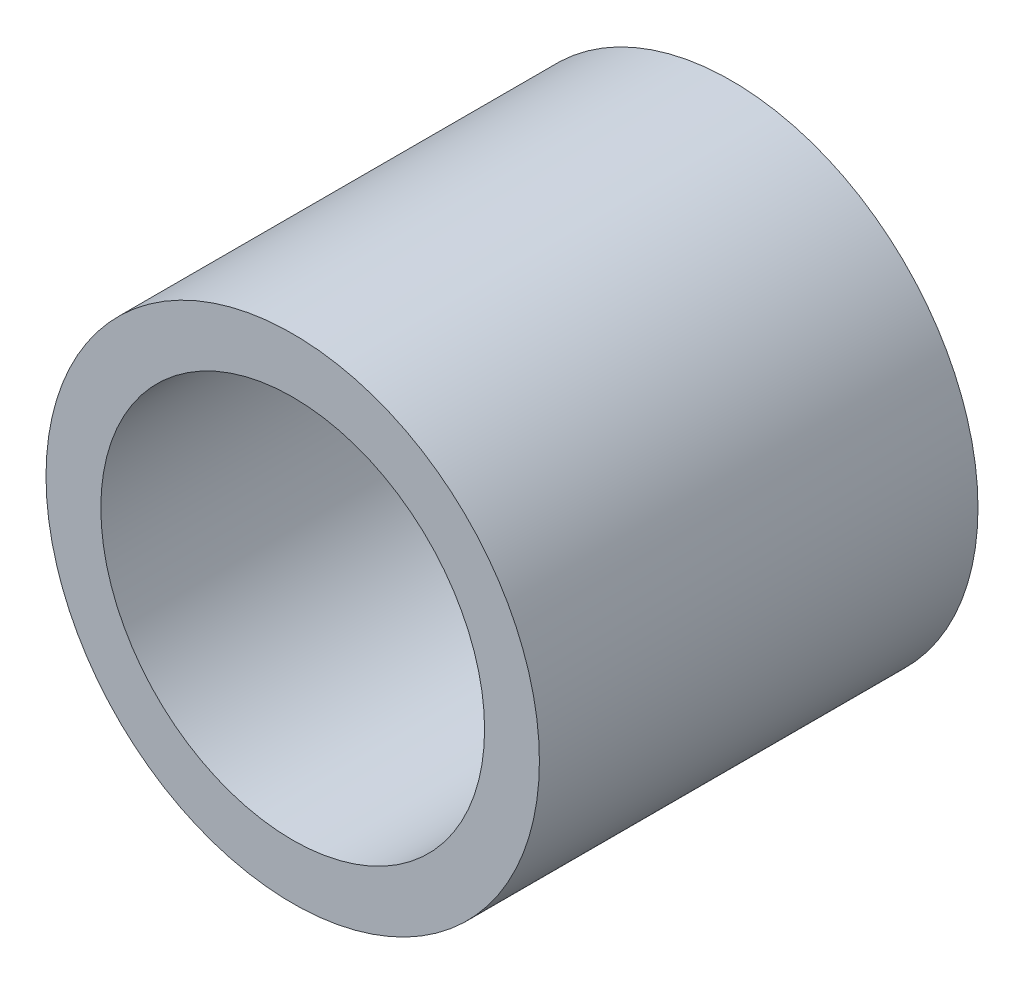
SolidWorks part; units mm, degrees
ref_plane "Face" through (0, 0, 0) normal (0, 0, 1) x (1, 0, 0)
ref_plane "Dessus" through (0, 0, 0) normal (0, 1, 0) x (1, 0, 0)
ref_plane "Droite" through (0, 0, 0) normal (1, 0, 0) x (0, 0, -1)
sketch "Esquisse1" plane through (0, 0, 0) normal (0, 0, 1) x (1, 0, 0)
  circle A0 centre (0, 0) radius 4.5
  circle A1 centre (0, 0) radius 3.5
  dimension "D1" = 7
  dimension "D2" = 9
extrude "Extrusion1" add sketch "Esquisse1" along normal blind 8
